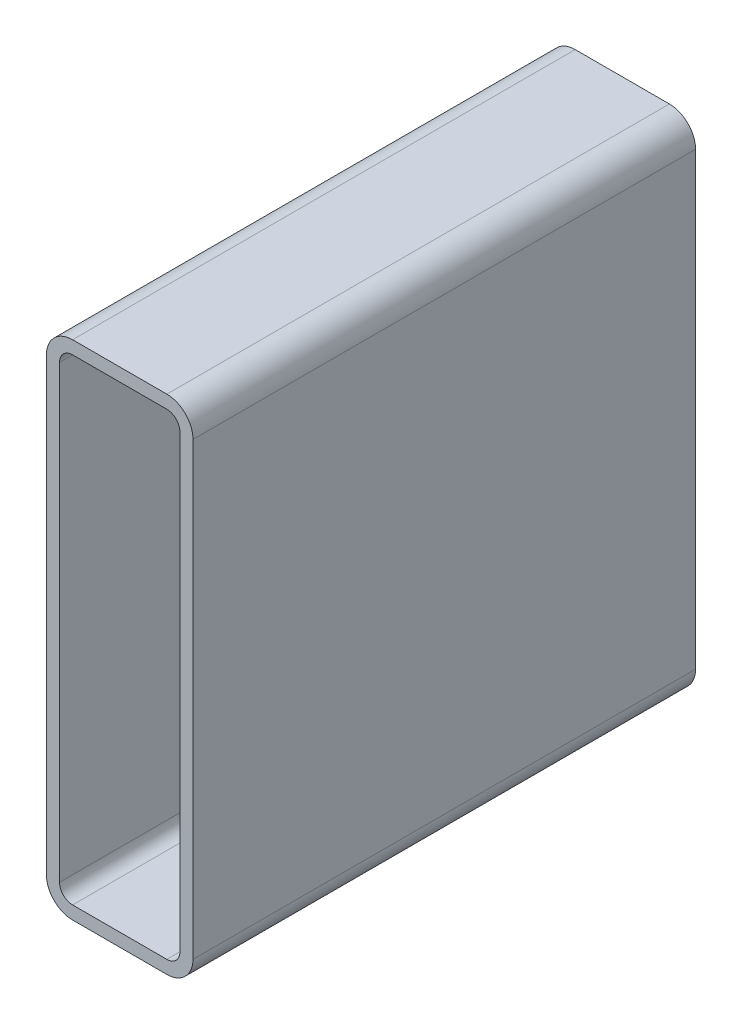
SolidWorks part; units mm, degrees
ref_plane "Front Plane" through (0, 0, 0) normal (0, 0, 1) x (1, 0, 0)
ref_plane "Top Plane" through (0, 0, 0) normal (0, 1, 0) x (1, 0, 0)
ref_plane "Right Plane" through (0, 0, 0) normal (1, 0, 0) x (0, 0, -1)
sketch "Sketch1" plane through (0, 0, 0) normal (0, 0, 1) x (1, 0, 0)
sketch_block_instance "HSS12x3.5x0.3125-1"
sketch_block "HSS12x3.5x0.3125"
extrude "Boss-Extrude1" add sketch "Sketch1" along normal blind 304.8
